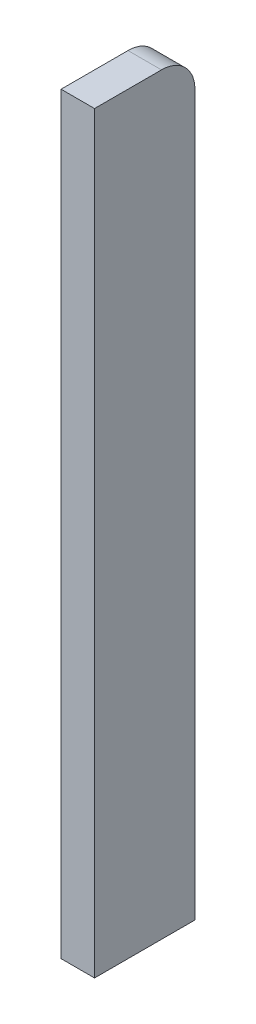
SolidWorks part; units mm, degrees
ref_plane "Front" through (0, 0, 0) normal (0, 0, 1) x (1, 0, 0)
ref_plane "Top" through (0, 0, 0) normal (0, 1, 0) x (1, 0, 0)
ref_plane "Right" through (0, 0, 0) normal (1, 0, 0) x (0, 0, -1)
sketch "Sketch3" plane through (0, 0, 0) normal (0, 0, -1) x (-1, 0, 0)
  line L1 (0, 142.875) -> (6.35, 142.875)
  line L2 (0, 142.875) -> (0, 0)
  line L3 (0, 0) -> (6.35, 0)
  line L4 (6.35, 142.875) -> (6.35, 0)
  dimension "D1" = 142.875
  dimension "D2" = 6.35
extrude "Extrude3" add sketch "Sketch3" along normal blind 19.05 separate body
fillet "Fillet1" radius 6.35 1 edges at (-3.175, 142.875, -19.05)
